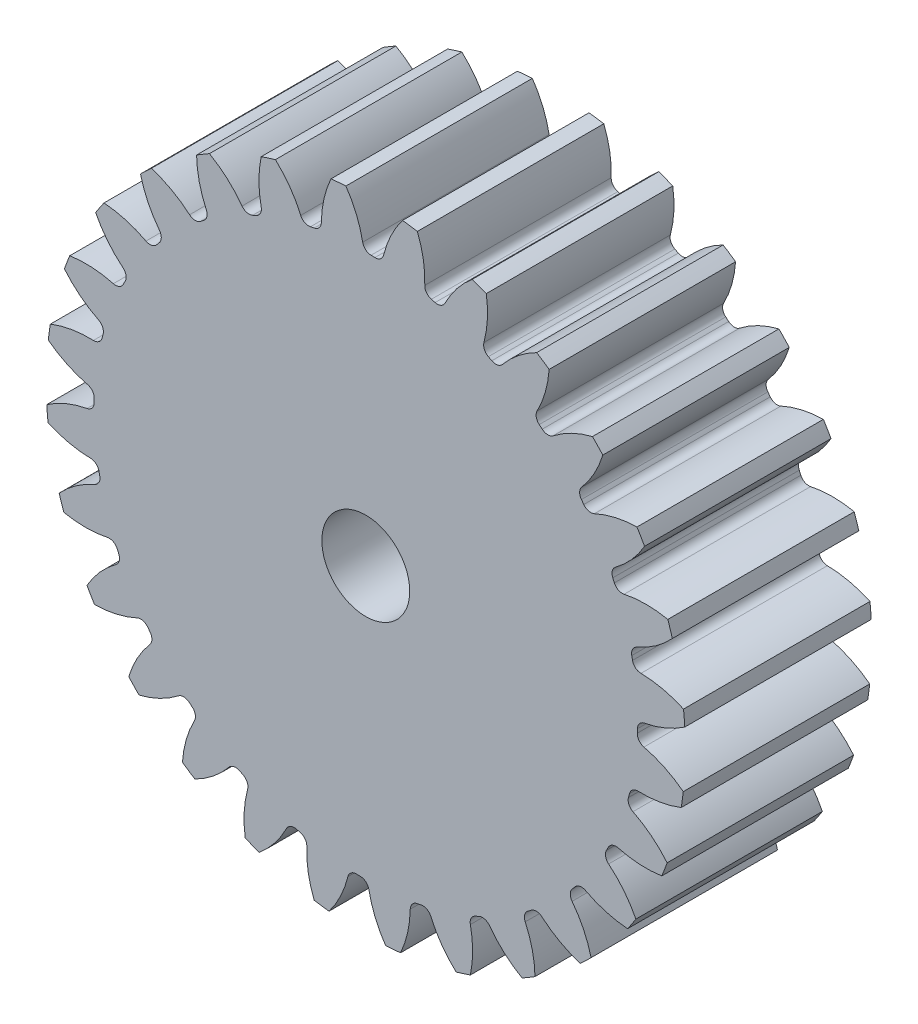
SolidWorks part; units mm, degrees
ref_plane "Front" through (0, 0, 0) normal (0, 0, 1) x (1, 0, 0)
ref_plane "Top" through (0, 0, 0) normal (0, 1, 0) x (1, 0, 0)
ref_plane "Right" through (0, 0, 0) normal (1, 0, 0) x (0, 0, -1)
sketch "Sketch3" plane through (0, 0, 0) normal (0, 0, 1) x (1, 0, 0)
  circle A0 centre (0, 0) radius 152.4
  dimension "od" = 304.8
extrude "gearBody" add sketch "Sketch3" along normal blind 88.9
sketch "Sketch2" plane through (0, 0, 0) normal (0, 0, 1) x (1, 0, 0)
  line L0 (0, 0) -> (123.4875, 51.1502) construction
  line L1 (151.6713, -17.7541) -> (0, 0) construction
  line L2 (0, 0) -> (36.3143, 0) construction
  line L3 (142.1787, 4.1758) -> (141.7565, -11.7179) construction
  line L5 (141.9676, -3.7711) -> (0, 0) construction
  line L7 (0, 0) -> (133.6619, 0) construction
  arc A0 (133.652, 1.6261) -> (133.3772, -8.7191) centre (0, 0) ccw construction
  arc A1 (152.1053, 9.4732) -> (151.3879, -17.5348) centre (0, 0) ccw construction
  arc A2 (142.1787, 4.1758) -> (141.7565, -11.7179) centre (0, 0) ccw construction
  arc A3 (129.4663, -4.3705) -> (129.5157, -2.5088) centre (0, 0) ccw
  arc A4 (151.6713, -17.7541) -> (132.616, -8.5266) centre (120.5979, -57.6338) ccw
  arc A5 (151.6713, -17.7541) -> (152.4, 9.6771) centre (0, 0) ccw
  arc A6 (152.4, 9.6771) -> (132.8817, 1.4742) centre (123.4875, 51.1502) cw
  arc A7 (129.5157, -2.5088) -> (132.8817, 1.4742) centre (133.65, -2.5889) cw
  arc A8 (132.616, -8.5266) -> (129.4663, -4.3705) centre (133.599, -4.51) cw
  point P6 (152.4, 9.6771)
  point P22 (151.6713, -17.7541)
  dimension "baseDia" = 267.3238
  dimension "od" = 304.8
  dimension "pd" = 284.48
  dimension "rd" = 259.08
  dimension "rFillet" = 4.1351
  dimension "pointX" = 152.4
  dimension "pointY" = 9.6771
  dimension "CTT" = 15.8937
  dimension "flankCenterAngle" = 22.5
extrude "toothCut" cut sketch "Sketch2" along normal through all
pattern_circular "CirPattern1" count 28 over 360 about axis through (0, 0, 0) along (0, 0, 1) of "toothCut"
sketch "hub1Dia" plane through (0, 0, 0) normal (0, 0, -1) x (-1, 0, 0)
  circle A0 centre (0, 0) radius 12.7
  dimension "hub1Dia" = 25.4
sketch "hub2Dia" plane through (0, 0, 88.9) normal (0, 0, 1) x (1, 0, 0)
  circle A0 centre (0, 0) radius 12.7
  dimension "hub2dia" = 25.4
sketch "boreDia" plane through (0, 0, 0) normal (0, 0, 1) x (1, 0, 0)
  circle A0 centre (0, 0) radius 20.955
  dimension "boreDia" = 41.91
extrude "bore" cut sketch "boreDia" against normal mid plane 25400
